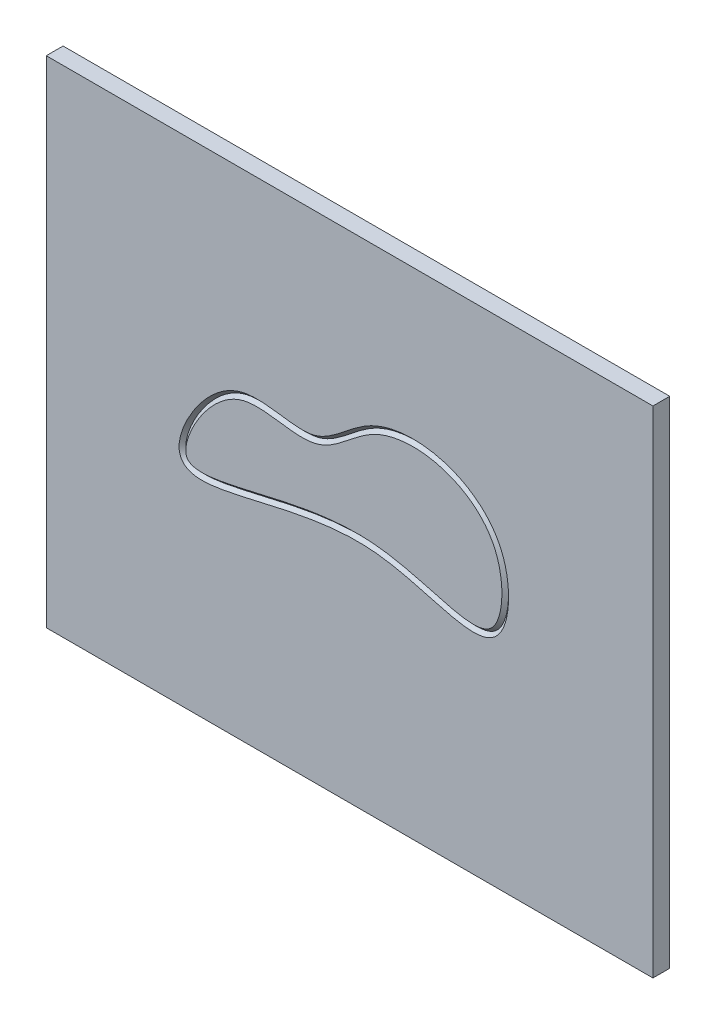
SolidWorks part; units mm, degrees
ref_plane "Ebene vorne" through (0, 0, 0) normal (0, 0, 1) x (1, 0, 0)
ref_plane "Ebene oben" through (0, 0, 0) normal (0, 1, 0) x (1, 0, 0)
ref_plane "Ebene rechts" through (0, 0, 0) normal (1, 0, 0) x (0, 0, -1)
sketch "Skizze1" plane through (0, 0, 0) normal (0, 0, 1) x (1, 0, 0)
  line L1 (0, 0) -> (541.6691, 0)
  line L2 (0, 0) -> (0, 442.3232)
  line L3 (0, 442.3232) -> (541.6691, 442.3232)
  line L4 (541.6691, 0) -> (541.6691, 442.3232)
extrude "Linear austragen1" add sketch "Skizze1" along normal blind 15
sketch "Skizze2" plane through (0, 0, 15) normal (0, 0, 1) x (1, 0, 0)
sketch_block_instance "SPLINE-1"
sketch_block "SPLINE"
ref_plane "Ebene1" through (239.6592, 265.5137, 15) normal (-0.971, -0.239, 0) x (0, 0, 1)
sketch "Skizze3" plane through (239.6592, 265.5137, 15) normal (-0.971, -0.239, 0) x (0, 0, 1)
  line L0 (0, 0) -> (-8.0829, 0) construction
  line L1 (0, 228.9591) -> (0, -200.5481) construction
  line L2 (-3, 0) -> (0, 3)
  line L3 (0, 3) -> (0, -3)
  line L4 (-3, 0) -> (0, -3)
  dimension "D1" = 3
sweep "Schnitt-Austragung1" cut profiles "Skizze3" path "Skizze2"
equation "\"LÄNGE\"=0"
equation "\"BREITE\"=0"
equation "\"HÖHE\"=0"
equation "\"DURCHMESSER\"=0"
equation "\"Stückzahl\"= 1"
